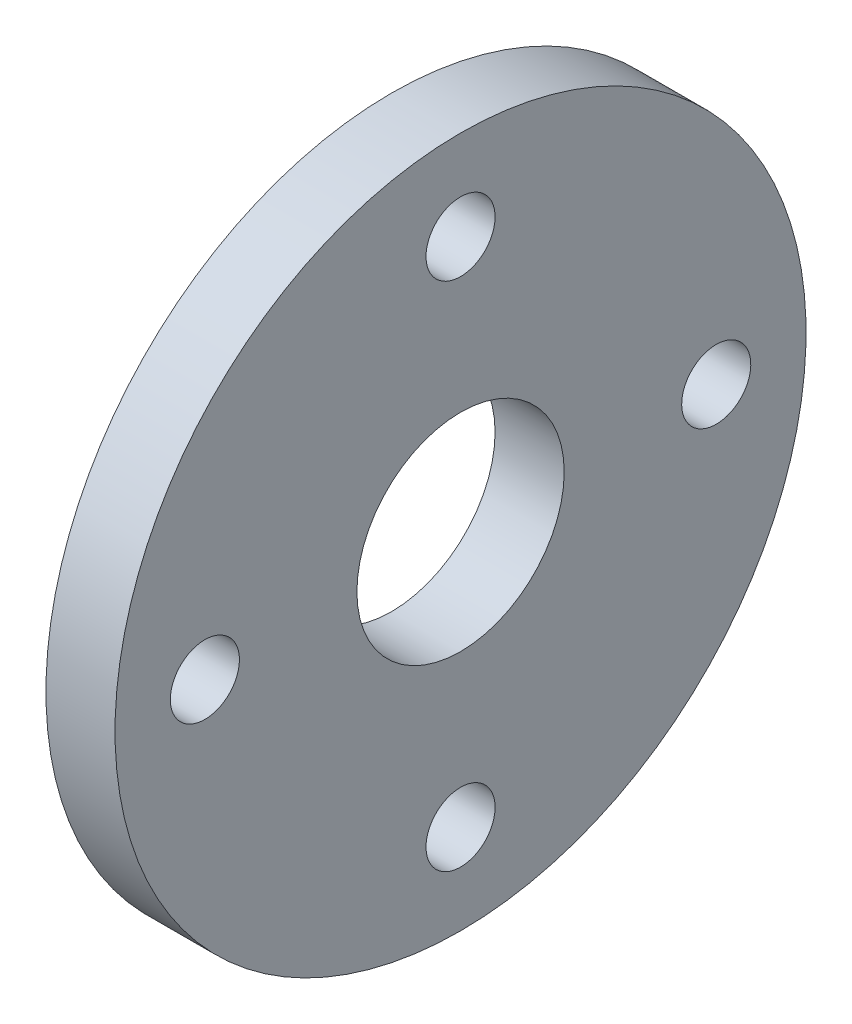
SolidWorks part; units mm, degrees
ref_plane "Front Plane" through (0, 0, 0) normal (0, 0, 1) x (1, 0, 0)
ref_plane "Top Plane" through (0, 0, 0) normal (0, 1, 0) x (1, 0, 0)
ref_plane "Right Plane" through (0, 0, 0) normal (1, 0, 0) x (0, 0, -1)
sketch "Sketch1" plane through (182.5, 0, 0) normal (1, 0, 0) x (0, 0, -1)
  circle A0 centre (0, 139) radius 50
  circle A1 centre (-37, 139) radius 5 construction
  circle A2 centre (0, 176) radius 5 construction
  circle A3 centre (37, 139) radius 5 construction
  circle A4 centre (0, 102) radius 5 construction
  circle A5 centre (-37, 139) radius 5
  circle A6 centre (0, 176) radius 5
  circle A7 centre (37, 139) radius 5
  circle A8 centre (0, 102) radius 5
  circle A9 centre (0, 139) radius 15 construction
  circle A10 centre (0, 139) radius 15
  dimension "D1" = 100
extrude "Boss-Extrude1" add sketch "Sketch1" along normal blind 10
